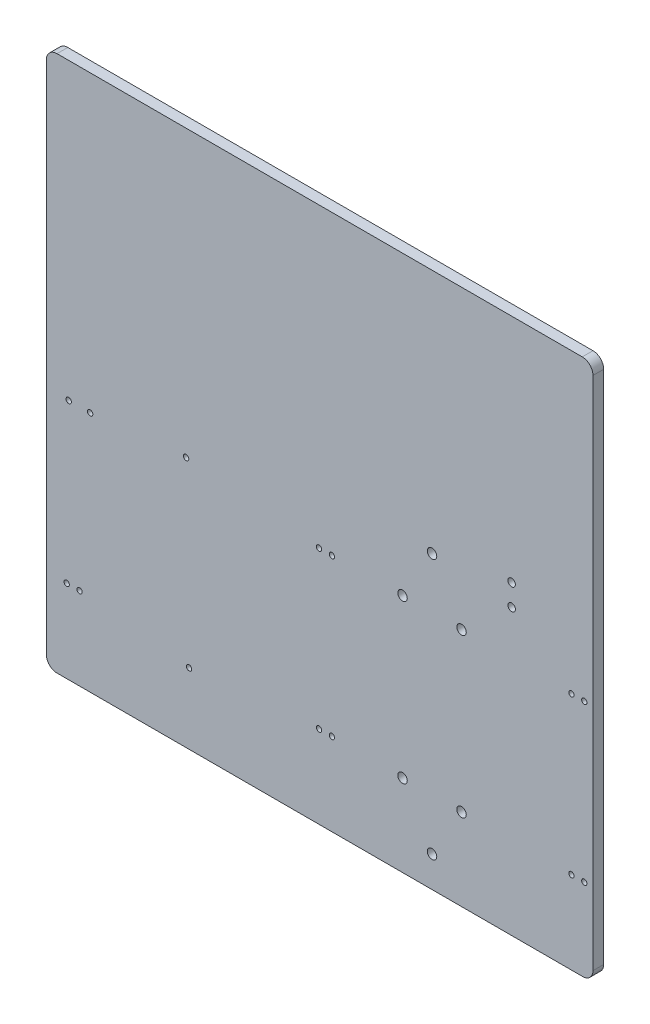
SolidWorks part; units mm, degrees
ref_plane "Front Plane" through (0, 0, 0) normal (0, 0, 1) x (1, 0, 0)
ref_plane "Top Plane" through (0, 0, 0) normal (0, 1, 0) x (1, 0, 0)
ref_plane "Right Plane" through (0, 0, 0) normal (1, 0, 0) x (0, 0, -1)
sketch "Sketch1" plane through (0, 0, 0) normal (0, 0, 1) x (1, 0, 0)
  line L0 (50.8, 9.525) -> (50.8, 290.475)
  line L1 (50.8, 290.475) -> (50.8, 500)
  line L2 (41.275, 0) -> (-458.725, 0)
  line L3 (41.275, 0) -> (41.275, 500)
  line L4 (41.275, 500) -> (-458.725, 500)
  line L5 (-458.725, 0) -> (-458.725, 500)
  line L8 (50.8, 500) -> (41.275, 500)
  circle A0 centre (-437.8688, 225.5) radius 2.4892 construction
  circle A2 centre (-71.7037, 223.625) radius 4.4005 construction
  arc A3 (41.275, 0) -> (50.8, 9.525) centre (41.275, 9.525) ccw
  circle A4 centre (-99.2, 271.25) radius 4.4006 construction
  circle A5 centre (-126.6963, 223.625) radius 4.4005 construction
  circle A6 centre (-71.7037, 76.375) radius 4.4005 construction
  circle A7 centre (-99.2, 28.75) radius 4.4006 construction
  circle A8 centre (-126.6963, 76.375) radius 4.4005 construction
  circle A9 centre (-71.7037, 223.625) radius 4.4005
  circle A10 centre (-99.2, 271.25) radius 4.4006
  circle A11 centre (-126.6963, 223.625) radius 4.4005
  circle A12 centre (-71.7037, 76.375) radius 4.4005
  circle A13 centre (-99.2, 28.75) radius 4.4005
  circle A14 centre (-126.6963, 76.375) radius 4.4005
  circle A15 centre (-417.8688, 225.5) radius 2.4892 construction
  circle A16 centre (-439.725, 77) radius 2.4892 construction
  circle A17 centre (-427.725, 77) radius 2.4765 construction
  circle A18 centre (-204.5062, 223) radius 2.4765 construction
  circle A19 centre (-192.5062, 223) radius 2.4892 construction
  circle A20 centre (-204.5063, 77) radius 2.4892 construction
  circle A21 centre (-192.5063, 77) radius 2.4765 construction
  circle A22 centre (-325.6523, 65.8) radius 2.4892 construction
  circle A29 centre (30.7125, 77) radius 2.4892 construction
  circle A30 centre (42.7125, 77) radius 2.4765 construction
  circle A31 centre (42.7125, 223) radius 2.4892 construction
  circle A32 centre (30.7125, 223) radius 2.4765 construction
  circle A33 centre (-25, 285) radius 3.5 construction
  circle A34 centre (-25, 265) radius 3.5 construction
  circle A37 centre (-328.4265, 234.2) radius 2.4892 construction
  circle A40 centre (-437.8688, 225.5) radius 2.4892
  circle A41 centre (-417.8688, 225.5) radius 2.4892
  circle A42 centre (-439.725, 77) radius 2.4892
  circle A43 centre (-427.725, 77) radius 2.4765
  circle A44 centre (-204.5062, 223) radius 2.4765
  circle A45 centre (-192.5062, 223) radius 2.4892
  circle A46 centre (-204.5063, 77) radius 2.4892
  circle A47 centre (-192.5063, 77) radius 2.4765
  circle A48 centre (-325.6523, 65.8) radius 2.4892
  circle A55 centre (30.7125, 77) radius 2.4892
  circle A56 centre (42.7125, 77) radius 2.4765
  circle A57 centre (42.7125, 223) radius 2.4892
  circle A58 centre (30.7125, 223) radius 2.4765
  circle A59 centre (-25, 285) radius 3.5
  circle A60 centre (-25, 265) radius 3.5
  circle A63 centre (-328.4265, 234.2) radius 2.4892
  point P8 (-208.725, 250)
  dimension "D1" = 500
  dimension "D2" = 500
extrude "Boss-Extrude1" add sketch "Sketch1" along normal blind 10
fillet "Fillet1" radius 10 3 edges at (50.8, 500, 5) (-458.725, 500, 5) (-458.725, 0, 5)
